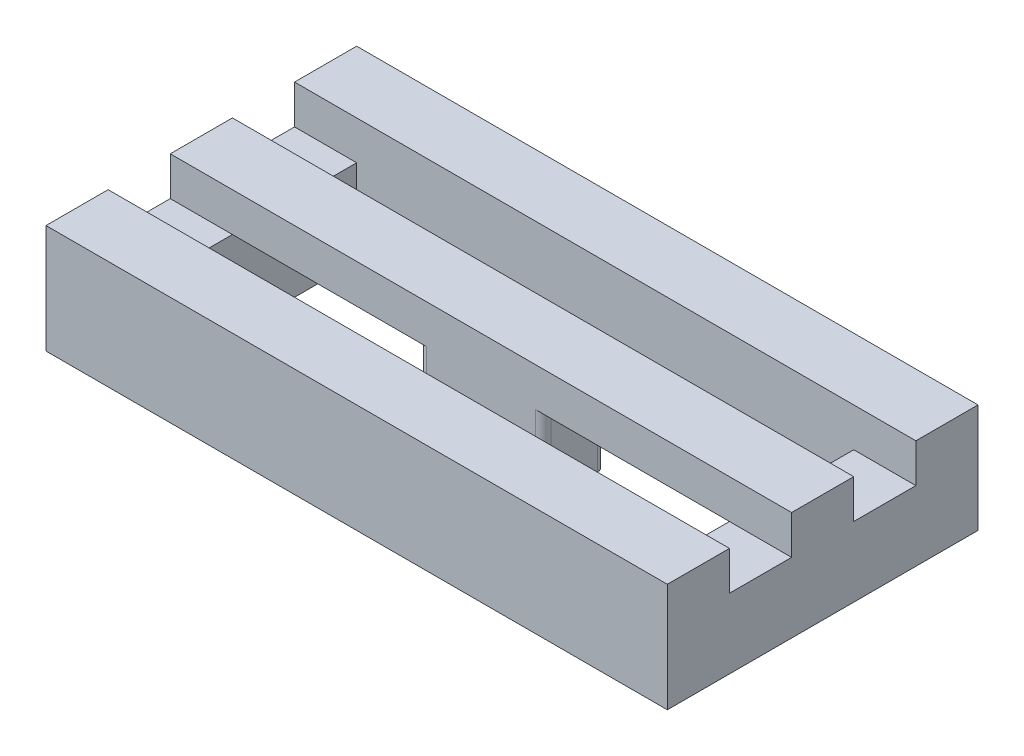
SolidWorks part; units mm, degrees
ref_plane "Vorne" through (0, 0, 0) normal (0, 0, 1) x (1, 0, 0)
ref_plane "Oben" through (0, 0, 0) normal (0, 1, 0) x (1, 0, 0)
ref_plane "Rechts" through (0, 0, 0) normal (1, 0, 0) x (0, 0, -1)
sketch "Skizze1" plane through (0, 0, 0) normal (0, 1, 0) x (1, 0, 0)
  line L1 (0, 0) -> (16, 0)
  line L2 (0, 0) -> (0, 8)
  line L3 (0, 8) -> (16, 8)
  line L4 (16, 0) -> (16, 8)
  dimension "D1" = 16
  dimension "D2" = 8
extrude "Linear austragen1" add sketch "Skizze1" along normal blind 3.2
sketch "Skizze2" plane through (0, 3.2, 0) normal (0, 1, 0) x (-1, 0, 0)
  line L0 (0, -8) -> (0, 0) construction
  line L1 (-16, 0) -> (0, 0)
  line L2 (-16, 0) -> (-16, -1.6)
  line L3 (-16, -1.6) -> (0, -1.6)
  line L4 (0, 0) -> (0, -1.6)
  line L5 (-16, 0) -> (-16, -8) construction
  line L6 (-16, -8) -> (0, -8)
  line L7 (-16, -8) -> (-16, -6.4)
  line L8 (-16, -6.4) -> (0, -6.4)
  line L9 (0, -8) -> (0, -6.4)
  line L10 (-16, -3.2) -> (0, -3.2)
  line L11 (-16, -3.2) -> (-16, -4.8)
  line L12 (-16, -4.8) -> (0, -4.8)
  line L13 (0, -3.2) -> (0, -4.8)
  dimension "D1" = 1.6
  dimension "D2" = 1.6
  dimension "D3" = 1.6
  dimension "D4" = 1.6
extrude "Schnitt-Linear austragen2" cut sketch "Skizze2" against normal blind 1 contours L12 L8 M3 M1 | L10 L3 M3 M1
sketch "Skizze4" plane through (0, 0, 0) normal (0, -1, 0) x (1, 0, 0)
  line L0 (0, 0) -> (16, 0) construction
  line L1 (1.6, -1.6) -> (14.4, -1.6)
  line L2 (1.6, -1.6) -> (1.6, -6.4)
  line L3 (1.6, -6.4) -> (14.4, -6.4)
  line L4 (14.4, -1.6) -> (14.4, -6.4)
  line L5 (16, -8) -> (0, -8) construction
  line L6 (0, -8) -> (0, 0) construction
  line L7 (16, 0) -> (16, -8) construction
  dimension "D1" = 1.6
  dimension "D2" = 1.6
  dimension "D3" = 1.6
  dimension "D4" = 1.6
extrude "Schnitt-Linear austragen3" cut sketch "Skizze4" against normal blind 2.2
sketch "Skizze5" plane through (0, 2.2, 0) normal (0, -1, 0) x (1, 0, 0)
  line L0 (14.4, -3.2) -> (1.6, -3.2) construction
  line L1 (6.4, -3.2) -> (9.6, -3.2)
  line L2 (6.4, -3.2) -> (6.4, -4.8)
  line L3 (6.4, -4.8) -> (9.6, -4.8)
  line L4 (9.6, -3.2) -> (9.6, -4.8)
  line L5 (14.4, -4.8) -> (1.6, -4.8) construction
  line L6 (8, -1.6) -> (8, -6.4) construction
  line L7 (14.4, -1.6) -> (1.6, -1.6) construction
  line L8 (1.6, -6.4) -> (14.4, -6.4) construction
  dimension "D1" = 1.6
  dimension "D2" = 1.6
extrude "Linear austragen2" add sketch "Skizze5" along normal blind 2
fillet "Verrundung1" radius 0.2 4 edges at (6.4, 1.2, -3.2) (6.4, 1.2, -4.8) (9.6, 1.2, -4.8) (9.6, 1.2, -3.2)
sketch "Skizze6" plane through (0, 0, 0) normal (0, -1, 0) x (1, 0, 0)
  line L0 (0, 0) -> (16, 0) construction
  line L1 (0.4, -0.4) -> (15.6, -0.4)
  line L2 (0.4, -0.4) -> (0.4, -7.6)
  line L3 (0.4, -7.6) -> (15.6, -7.6)
  line L4 (15.6, -0.4) -> (15.6, -7.6)
  line L5 (16, -8) -> (0, -8) construction
  line L6 (0, -3.2) -> (0, -1.6) construction
  line L7 (16, 0) -> (16, -8) construction
  point P8 (0, -2.4)
  dimension "D1" = 0.4
  dimension "D2" = 0.4
  dimension "D3" = 0.4
  dimension "D4" = 0.4
extrude "Schnitt-Linear austragen4" cut sketch "Skizze6" against normal blind 0.4 contours L1 L4 L3 L2 M5 M6 M7 M8
